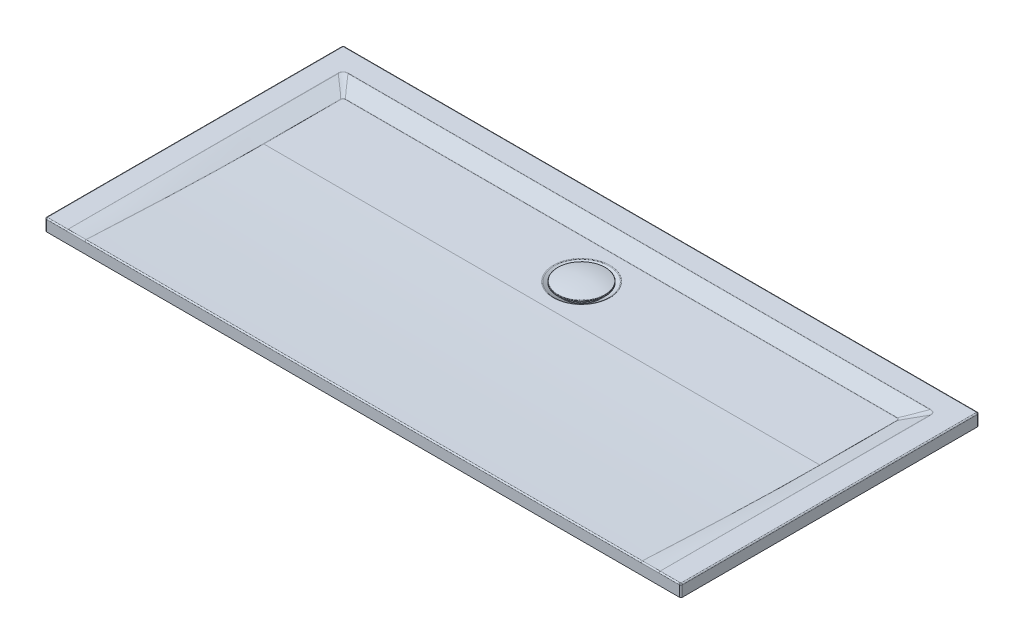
SolidWorks part; units mm, degrees
ref_plane "Płaszczyzna przednia" through (0, 0, 0) normal (0, 0, 1) x (1, 0, 0)
ref_plane "Płaszczyzna górna" through (0, 0, 0) normal (0, 1, 0) x (1, 0, 0)
ref_plane "Płaszczyzna prawa" through (0, 0, 0) normal (1, 0, 0) x (0, 0, -1)
sketch "Szkic1" plane through (0, 0, 0) normal (0, 1, 0) x (1, 0, 0)
  line L0 (0, 375) -> (0, -375) construction
  line L1 (-800, 375) -> (800, 375)
  line L2 (-800, 375) -> (-800, -375)
  line L3 (-800, -375) -> (800, -375)
  line L4 (800, 375) -> (800, -375)
  line L5 (-745, -375) -> (-745, 320)
  line L6 (-745, 320) -> (745, 320)
  line L7 (745, 320) -> (745, -375)
  line L8 (-700, -375) -> (-700, 275)
  line L9 (-700, 275) -> (700, 275)
  line L10 (700, 275) -> (700, -375)
  circle A0 centre (0, 175) radius 45
  circle A1 centre (0, 175) radius 70
  point P9 (0, 320)
  dimension "D6" = 90
  dimension "D7" = 140
  dimension "D1" = 1600
  dimension "D2" = 55
  dimension "D3" = 55
  dimension "D5" = 200
  dimension "D8" = 750
  dimension "D4" = 45
sketch "Szkic2" plane through (0, 0, 0) normal (0, 1, 0) x (1, 0, 0)
  line L0 (-800, -375) -> (800, -375) construction
  line L1 (800, 375) -> (800, -375) construction
  line L2 (745, 320) -> (745, -375) construction
  line L3 (-745, 320) -> (745, 320) construction
  line L4 (-800, 375) -> (800, 375) construction
  line L5 (-745, -375) -> (-745, 320) construction
  line L6 (-800, 375) -> (-800, -375) construction
  line L7 (-800, -375) -> (-745, -375)
  line L8 (800, 375) -> (800, -375)
  line L9 (745, 320) -> (745, -375)
  line L10 (-745, 320) -> (745, 320)
  line L11 (-800, 375) -> (800, 375)
  line L12 (-745, -375) -> (-745, 320)
  line L13 (-800, 375) -> (-800, -375)
  line L14 (745, -375) -> (800, -375)
surface "Powierzchnia-Płaszczyzna1" sketch "Szkic2"
ref_plane "Płaszczyzna1" through (0, -15, 0) normal (0, 1, 0) x (-1, 0, 0)
sketch "Szkic3" plane through (0, -15, 0) normal (0, 1, 0) x (-1, 0, 0)
  line L0 (700, -75) -> (-700, -75)
  line L1 (700, 375) -> (700, -275) construction
  line L2 (-700, -275) -> (-700, 375) construction
  line L3 (0, -75) -> (0, -275) construction
  line L4 (700, -275) -> (-700, -275) construction
  line L5 (-700, -275) -> (-700, -75)
  line L6 (700, -75) -> (700, -275)
  line L7 (700, -275) -> (-700, -275)
  circle A0 centre (0, -175) radius 70 construction
  circle A1 centre (0, -175) radius 70
  point P10 (0, -175)
surface "Powierzchnia-Płaszczyzna2" sketch "Szkic3"
sketch "Szkic4" plane through (0, 0, 0) normal (0, 1, 0) x (1, 0, 0)
  line L0 (700, -375) -> (-700, -375)
other "Granica-Powierzchnia1"
other "Granica-Powierzchnia2"
other "Granica-Powierzchnia3"
mirror "Lustro1" about plane through (0, 0, 0) normal (1, 0, 0)
sketch "Szkic5" plane through (0, 0, 0) normal (0, 1, 0) x (1, 0, 0)
  line L0 (800, 375) -> (800, -375) construction
  line L1 (-800, 375) -> (800, 375) construction
  line L2 (-800, 375) -> (-800, -375) construction
  line L3 (-800, -375) -> (800, -375) construction
  line L4 (800, 375) -> (800, -375)
  line L5 (-800, 375) -> (800, 375)
  line L6 (-800, 375) -> (-800, -375)
  line L7 (-800, -375) -> (800, -375)
surface "Powierzchnia-Wyciągnięcie1" sketch "Szkic5" parameters "D1"=30
sketch "Szkic7" plane through (0, 0, 0) normal (1, 0, 0) x (0, 0, -1)
  line L0 (175, 0) -> (175, -30) construction
  line L1 (375, -30) -> (-375, -30) construction
  line L2 (220, -30) -> (220, -28)
  line L3 (220, -28) -> (224, -28)
  line L6 (224, -28) -> (245, -15)
  dimension "D1" = 90
  dimension "D2" = 2
  dimension "D3" = 98
surface "Powierzchnia-Obrót wokół linii środkowej1" sketch "Szkic7" parameters "D1"=360
surface "Powierzchnia-Płaszczyzna3"
surface "Powierzchnia-Połącz1"
fillet "Zaokrąglenie1" radius 4 6 edges at (0, -28, -224) (0, -15, -105) (800, -15, 375) (800, -15, -375) (-800, -15, -375) (-800, -15, 375)
fillet "Zmienne zaokrąglenie1" radius 40 2 edges at (722.5, -7.5, -297.5)
fillet "Zaokrąglenie3" radius 3 12 edges
fillet "Zaokrąglenie4" radius 3 12 edges at (-798.8284, 0, -373.8284) (0, 0, -375) (798.8284, 0, -373.8284) (800, 0, 0) (798.8284, 0, 373.8284) (770.5, 0, 375) (-770.5, 0, 375) (-798.8284, 0, 373.8284) (-800, 0, 0)
sketch "Szkic8" plane through (0, 0, 0) normal (1, 0, 0) x (0, 0, -1)
  line L0 (175, 0) -> (175, -30) construction
  line L1 (175, -5.6601) -> (179.8469, -5.6601) construction
  line L2 (235, -14.7573) -> (235, -17)
  line L3 (235, -17) -> (175, -17)
  line L4 (175, -17) -> (175, -5.6601)
  line L5 (175, -5.6601) -> (199.9922, 95.6514)
  arc A0 (175, -5.6601) -> (234.2694, -13.7943) centre (175, -225.6601) cw
  arc A1 (234.2694, -13.7943) -> (235, -14.7573) centre (234, -14.7573) cw
  point P11 (235, -14)
  dimension "D1" = 220
  dimension "D4" = 1
  dimension "D2" = 60
  dimension "D3" = 3
  dimension "D5" = 13
revolve "Obrót wokół linii środkowej1" add sketch "Szkic8" angle 360 about L4
